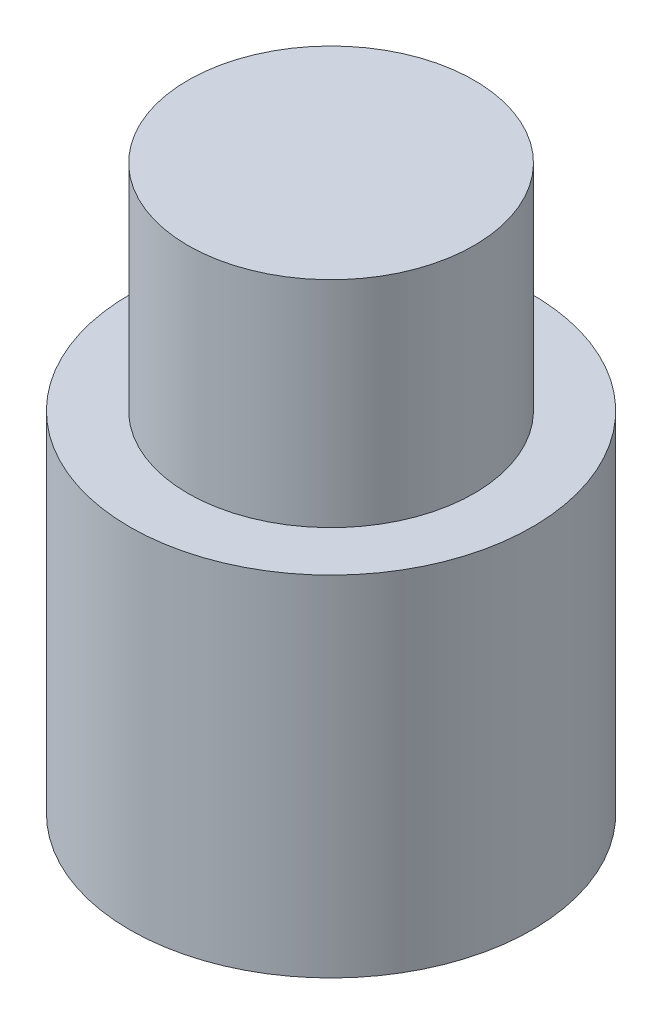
SolidWorks part; units mm, degrees
ref_plane "Front" through (0, 0, 0) normal (0, 0, 1) x (1, 0, 0)
ref_plane "Top" through (0, 0, 0) normal (0, 1, 0) x (1, 0, 0)
ref_plane "Right" through (0, 0, 0) normal (1, 0, 0) x (0, 0, -1)
sketch "Sketch1" plane through (0, 0, 0) normal (1, 0, 0) x (0, 0, -1)
  line L0 (0, 345.6222) -> (0, -606.2651) construction
  line L1 (0, 0) -> (503.1062, 0) construction
  line L2 (203.2, 400.05) -> (203.2, 95.25)
  line L3 (203.2, -400.05) -> (0, -400.05)
  line L4 (0, 400.05) -> (0, -400.05)
  line L5 (203.2, -400.05) -> (285.75, -400.05)
  line L6 (285.75, -400.05) -> (285.75, 95.25)
  line L7 (203.2, 400.05) -> (0, 400.05)
  line L8 (285.75, 95.25) -> (203.2, 95.25)
  point P7 (203.2, 0)
  dimension "D1" = 406.4
  dimension "D2" = 800.1
  dimension "D3" = 571.5
  dimension "D4" = 304.8
revolve "Revolve1" add sketch "Sketch1" angle 360 about L0
sketch "Sketch2" [suppressed] plane through (0, 0, 0) normal (0, 1, 0) x (-1, 0, 0)
  line L0 (0, 0) -> (0, -64.235) construction
  line L1 (0, 0) -> (-217.6757, 0) construction
  circle A0 centre (-152.4, 0) radius 4.7625
  dimension "D1" = 9.525
  dimension "D2" = 152.4
extrude "Extrude1" [suppressed] add sketch "Sketch2" along normal blind 254
mirror "Mirror1" [suppressed] about plane through (0, 0, 0) normal (1, 0, 0)
